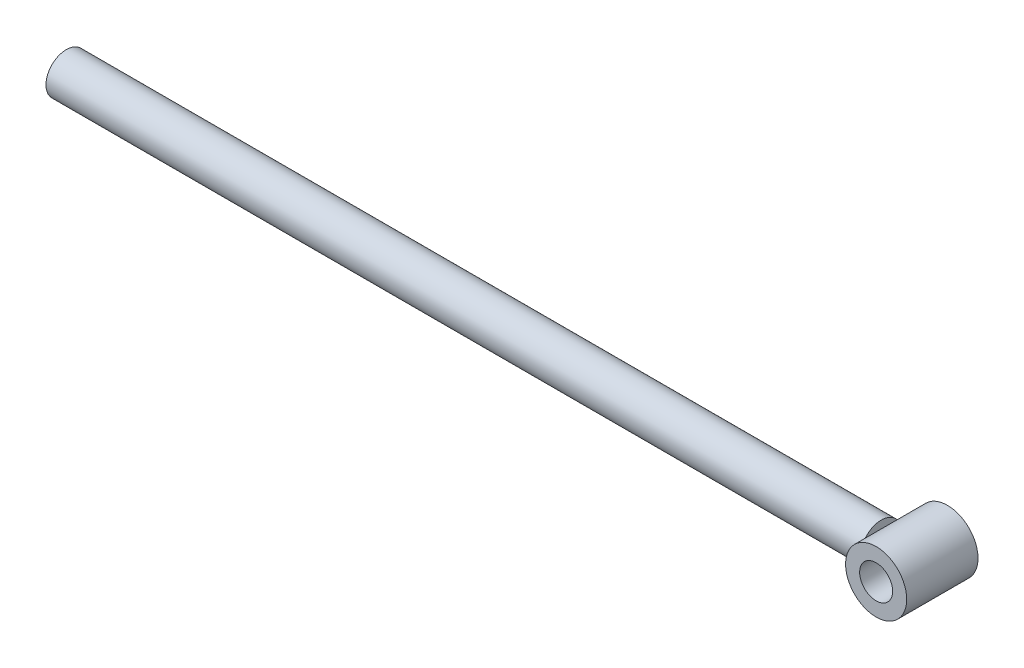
SolidWorks part; units mm, degrees
ref_plane "Plan de face" through (0, 0, 0) normal (0, 0, 1) x (1, 0, 0)
ref_plane "Plan de dessus" through (0, 0, 0) normal (0, 1, 0) x (1, 0, 0)
ref_plane "Plan de droite" through (0, 0, 0) normal (1, 0, 0) x (0, 0, -1)
sketch "Esquisse1" plane through (0, 0, 0) normal (1, 0, 0) x (0, 0, -1)
  circle A0 centre (0, 0) radius 10
  dimension "D1" = 20
extrude "Extrusion1" add sketch "Esquisse1" along normal blind 400
sketch "Esquisse2" plane through (0, 0, 0) normal (0, 0, 1) x (1, 0, 0)
  line L0 (400, -10) -> (400, 10) construction
  circle A0 centre (415, 0) radius 15
  circle A1 centre (415, 0) radius 8.1
  dimension "D1" = 16.2
  dimension "D2" = 30
extrude "Extrusion2" add sketch "Esquisse2" along normal mid plane 35
ref_plane "Plan1" through (387, 0, 0) normal (1, 0, 0) x (0, 0, -1)
